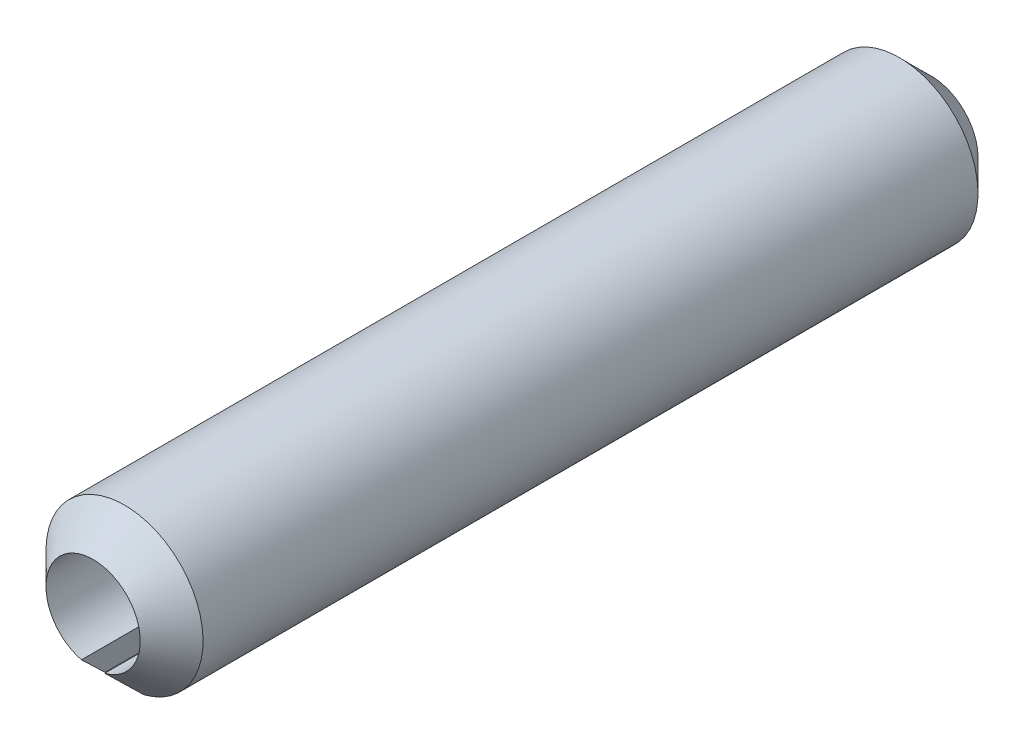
SolidWorks part; units mm, degrees
ref_plane "face" through (0, 0, 0) normal (0, 0, 1) x (1, 0, 0)
ref_plane "dessus" through (0, 0, 0) normal (0, 1, 0) x (1, 0, 0)
ref_plane "profil" through (0, 0, 0) normal (1, 0, 0) x (0, 0, -1)
sketch "Esquisse1" plane through (0, 0, 0) normal (0, 0, 1) x (1, 0, 0)
  line L0 (-0.2226, -0.872) -> (-0.371, -1.4534)
  line L1 (0, 0) -> (0, -2.3783) construction
  line L2 (0.2226, -0.872) -> (0.371, -1.4534)
  arc A0 (0.371, -1.4534) -> (-0.371, -1.4534) centre (0, 0) ccw
  arc A1 (0.2226, -0.872) -> (-0.2226, -0.872) centre (0, 0) ccw
  dimension "D1" = 1.8
  dimension "D2" = 3
  dimension "D3" = 14.32
extrude "Base-Extrusion" add sketch "Esquisse1" against normal blind 16
chamfer "Chanfrein1" distance 0.6 angle 45
